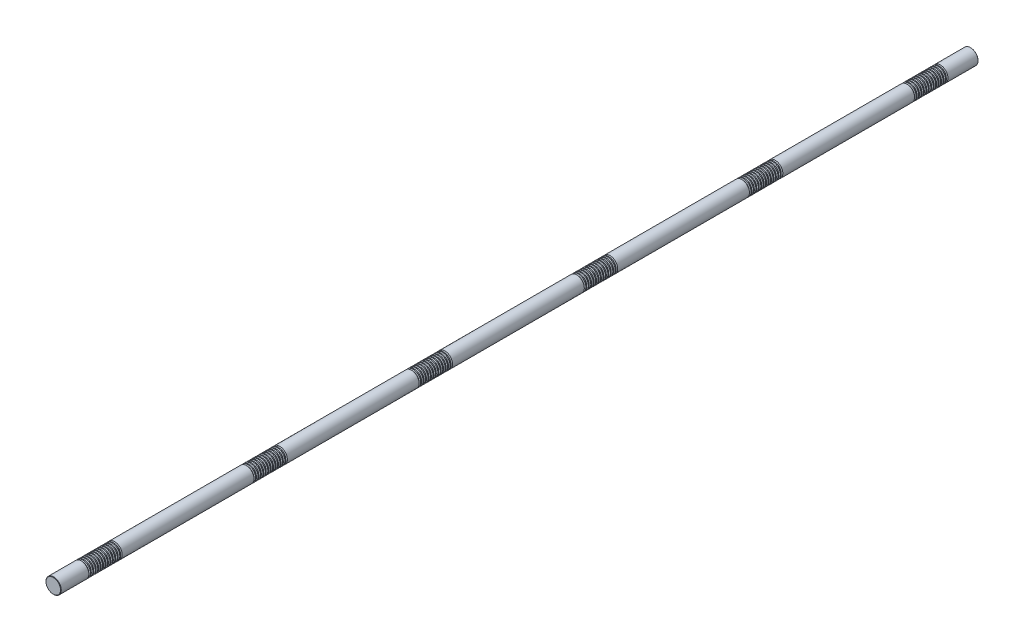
SolidWorks part; units mm, degrees
ref_plane "Front Plane" through (0, 0, 0) normal (0, 0, 1) x (1, 0, 0)
ref_plane "Top Plane" through (0, 0, 0) normal (0, 1, 0) x (1, 0, 0)
ref_plane "Right Plane" through (0, 0, 0) normal (1, 0, 0) x (0, 0, -1)
sketch "Sketch1" plane through (0, 0, 0) normal (0, 0, 1) x (1, 0, 0)
  circle A0 centre (0, 0) radius 25
  dimension "D1" = 50
extrude "Boss-Extrude1" add sketch "Sketch1" along normal mid plane 3000
chamfer "Chamfer1" distance 1.25 angle 45 2 edges at (25, 0, -1500) (25, 0, 1500)
sketch "Sketch2" plane through (0, 0, 0) normal (1, 0, 0) x (0, 0, -1)
  line L0 (1400.6029, 25) -> (1395.3971, 25)
  line L1 (1498.75, 25) -> (-1498.75, 25) construction
  line L2 (1395.3971, 25) -> (1396.6029, 20.5)
  line L3 (1396.6029, 20.5) -> (1399.3971, 20.5)
  line L4 (1399.3971, 20.5) -> (1400.6029, 25)
  line L5 (1500, -23.75) -> (1500, 23.75) construction
  point P4 (1398, 25)
  point P7 (1398, 20.5)
  point P8 (1400, 22.75)
  point P9 (1396, 22.75)
  dimension "D1" = 4
  dimension "D2" = 100
  dimension "D3" = 4.5
  dimension "D4" = 30
revolve "Cut-Revolve1" cut sketch "Sketch2" angle 360 about axis through (0, 0, 1500) along (0, 0, -1)
pattern_linear "LPattern1" count 14 spacing 8 along (0, 0, 1) of "Cut-Revolve1"
pattern_linear "LPattern2" count 6 spacing 540 along (0, 0, 1) of "Cut-Revolve1", "LPattern1"
